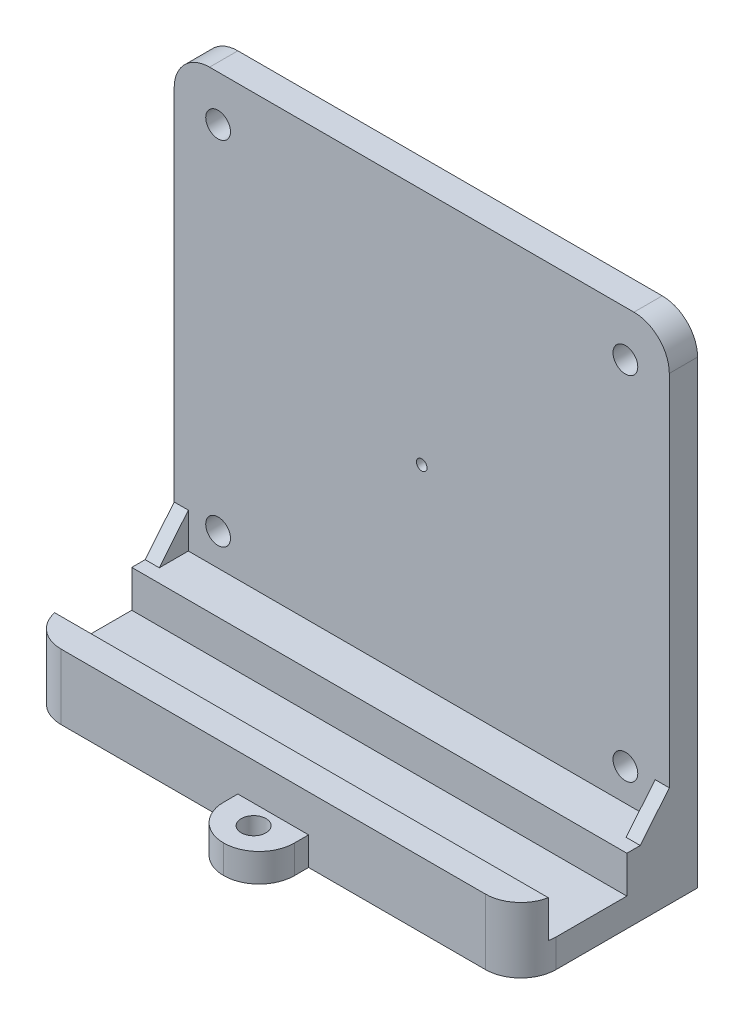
SolidWorks part; units mm, degrees
ref_plane "Front Plane" through (0, 0, 0) normal (0, 0, 1) x (1, 0, 0)
ref_plane "Top Plane" through (0, 0, 0) normal (0, 1, 0) x (1, 0, 0)
ref_plane "Right Plane" through (0, 0, 0) normal (1, 0, 0) x (0, 0, -1)
sketch "Sketch1" plane through (0, 0, 0) normal (1, 0, 0) x (0, 0, -1)
  line L0 (-10.2041, -5.3146) -> (14.7959, -5.3146)
  line L1 (-10.2041, -5.3146) -> (-10.2041, 3.9354)
  line L2 (-10.2041, 3.9354) -> (-6.2041, 3.9354)
  line L3 (-6.2041, 3.9354) -> (-6.2041, -1.3146)
  line L4 (-6.2041, -1.3146) -> (4.7959, -1.3146)
  line L5 (4.7959, -1.3146) -> (4.7959, 3.9354)
  line L6 (4.7959, 3.9354) -> (10.7959, 3.9354)
  line L7 (10.7959, 3.9354) -> (10.7959, 64.6854)
  line L8 (10.7959, 64.6854) -> (14.7959, 64.6854)
  line L9 (14.7959, 64.6854) -> (14.7959, -5.3146)
  dimension "D1" = 4
  dimension "D2" = 11
  dimension "D3" = 6
  dimension "D4" = 5.25
  dimension "D5" = 9.25
  dimension "D6" = 9.25
  dimension "D7" = 4
  dimension "D8" = 70
extrude "Boss-Extrude1" add sketch "Sketch1" against normal blind 70
sketch "Sketch2" plane through (0, 0, -10.7959) normal (0, 0, 1) x (1, 0, 0)
  line L0 (0, 64.6854) -> (0, 3.9354) construction
  line L1 (-70, 3.9354) -> (0, 3.9354) construction
  circle A0 centre (-35, 34.6854) radius 0.75
  dimension "D3" = 1.5
  dimension "D1" = 35
  dimension "D2" = 30.75
extrude "Cut-Extrude1" cut sketch "Sketch2" against normal through all
fillet "Fillet1" radius 5 2 edges at (0, 64.6854, -12.7959) (-70, 64.6854, -12.7959)
sketch "Sketch3" plane through (0, 0, 0) normal (1, 0, 0) x (0, 0, -1)
  line L0 (10.7959, 8.9412) -> (6.6888, 3.9354)
  line L1 (10.7959, 59.6854) -> (10.7959, 3.9354) construction
  line L2 (10.7959, 3.9354) -> (4.7959, 3.9354) construction
  line L3 (6.6888, 3.9354) -> (10.7959, 3.9354)
  line L4 (10.7959, 3.9354) -> (10.7959, 8.9412)
extrude "Boss-Extrude2" add sketch "Sketch3" against normal blind 2
sketch "Sketch4" plane through (0, 0, -10.7959) normal (0, 0, 1) x (1, 0, 0)
  line L0 (-35, 34.6854) -> (-35, 9.3572) construction
  line L1 (-35, 34.6854) -> (-35, 97.3356) construction
ref_plane "Plane1" through (-35, 0, 0) normal (1, 0, 0) x (0, 1, 0)
mirror "Mirror1" about plane through (-35, 0, 0) normal (1, 0, 0) of "Boss-Extrude2"
sketch "Sketch5" plane through (0, 0, -10.7959) normal (0, 0, 1) x (1, 0, 0)
  circle A0 centre (-6.2068, 58.2516) radius 1.75
  circle A1 centre (-6.2068, 8.4625) radius 1.75
  point P4 (0, 0)
  dimension "D1" = 3.5
  dimension "D2" = 3.5
extrude "Cut-Extrude2" cut sketch "Sketch5" against normal through all
mirror "Mirror2" about plane through (-35, 0, 0) normal (1, 0, 0) of "Cut-Extrude2"
sketch "Sketch6" plane through (0, 0, 10.2041) normal (0, 0, 1) x (1, 0, 0)
  line L0 (-70, -5.3146) -> (0, -5.3146) construction
  line L1 (-40, -5.3146) -> (-30, -5.3146)
  line L2 (-40, -5.3146) -> (-40, -1.3146)
  line L3 (-40, -1.3146) -> (-30, -1.3146)
  line L4 (-30, -5.3146) -> (-30, -1.3146)
  line L6 (0, 3.9354) -> (0, -5.3146) construction
  line L8 (-70, 3.9354) -> (-70, -5.3146) construction
  dimension "D1" = 30
  dimension "D2" = 30
  dimension "D3" = 4
extrude "Boss-Extrude3" add sketch "Sketch6" along normal blind 7
fillet "Fillet2" radius 5 4 edges at (-30, -3.3146, 17.2041) (-40, -3.3146, 17.2041) (-70, -0.6896, 10.2041) (0, -0.6896, 10.2041)
sketch "Sketch7" plane through (0, -1.3146, 0) normal (0, 1, 0) x (1, 0, 0)
  circle A0 centre (-35.0035, -12.9713) radius 1.75
  dimension "D1" = 3.5
extrude "Cut-Extrude4" cut sketch "Sketch7" against normal blind 7
sketch "Sketch8" plane through (0, 0, -10.7959) normal (0, 0, 1) x (1, 0, 0)
  line L0 (-35, 34.6854) -> (-30.1399, 34.6854) construction
  circle A0 centre (-35, 30.9854) radius 0.75
  dimension "D2" = 1.5
  dimension "D1" = 3.7
extrude "Cut-Extrude5" cut sketch "Sketch8" against normal blind 7
sketch "Sketch10" plane through (0, 0, -14.7959) normal (0, 0, -1) x (-1, 0, 0)
  circle A0 centre (35, 34.6854) radius 0.75
extrude "Boss-Extrude4" add sketch "Sketch10" against normal up to surface (4 mm away)
